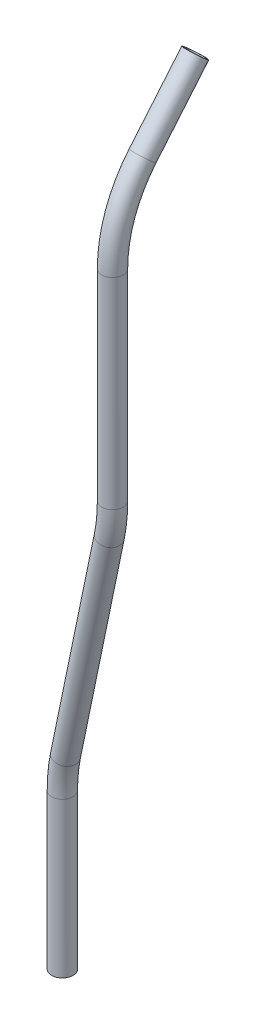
SolidWorks part; units mm, degrees
ref_plane "Front Plane" through (0, 0, 0) normal (0, 0, 1) x (1, 0, 0)
ref_plane "Top Plane" through (0, 0, 0) normal (0, 1, 0) x (1, 0, 0)
ref_plane "Right Plane" through (0, 0, 0) normal (1, 0, 0) x (0, 0, -1)
sketch3d "3DSketch1"
  line L0 (0, 0, 0) -> (0, 45.784, 0)
  line L1 (1.258, 55.645, 0.3207) -> (18.6505, 122.6308, 4.7546)
  line L2 (19.9085, 132.4918, 5.0753) -> (19.9085, 191.9949, 5.0753)
  line L3 (19.9085, 216.4852, -3.8384) -> (19.9085, 235.0485, -19.4149)
  line L6 (19.9085, 229.8203, -15.0279) -> (19.9085, 238.9425, -22.6824) construction
  arc A0 (19.9085, 191.9949, 5.0753) -> (19.9085, 216.4852, -3.8384) centre (19.9085, 191.9949, -33.0247) ccw
  arc A1 (18.6505, 122.6308, 4.7546) -> (19.9085, 132.4918, 5.0753) centre (-17.0107, 132.4918, -4.3365) ccw
  arc A2 (0, 45.784, 0) -> (1.258, 55.645, 0.3207) centre (36.9192, 45.784, 9.4118) ccw
  point P4 (19.9085, 205.8622, 5.0753)
  point P7 (-18.1915, 191.9949, -33.0247)
  point P10 (19.9085, 127.4759, 5.0753)
  point P12 (-26.4225, 132.4918, 32.5827)
  point P15 (0, 50.8, 0)
  point P17 (46.331, 45.784, -27.5074)
  dimension "D5" = 38.1
  dimension "D1" = 50.8
  dimension "D2" = 9.525
  dimension "D3" = 38.1
  dimension "D4" = 15
other "Structural Member1"
ref_plane "Plane1" through (0, 0, 0) normal (0, 1, 0) x (1, 0, 0)
sketch "Sketch1" plane through (0, 0, 0) normal (0, 1, 0) x (1, 0, 0)
  circle A0 centre (0, 0) radius 3.175
  circle A1 centre (0, 0) radius 2.667
  point P4 (0, 0)
  dimension "D1" = 6.35
  dimension "D2" = 0.508
sketch3d "3DSketch2" [suppressed]
  line L0 (0, 0, 0) -> (0, -7.1635, 0)
  line L1 (5.6025, -26.6656, 7.2045) -> (6.8276, -28.331, 8.78)
  line L3 (9.6583, -41.9513, 18.8369) -> (8.0602, -50.4208, 23.7695)
  line L4 (9.1586, -44.6, 20.3795) -> (7.2422, -54.7562, 26.2944) construction
  arc A0 (6.8276, -28.331, 8.78) -> (9.6583, -41.9513, 18.8369) centre (-14.1219, -42.6465, 9.9387) ccw
  arc A1 (5.6025, -26.6656, 7.2045) -> (0, -7.1635, 0) centre (15.5923, -7.1635, 20.0509) ccw
  point P4 (11.1259, -34.1737, 14.3073)
  point P9 (-6.1876, -55.8903, -10.2308)
  point P12 (0, -19.05, 0)
  point P14 (35.6432, -7.1635, 4.4586)
  point P18 (-6.35, 25.2705, 14.9247)
  dimension "D4" = 25.4
  dimension "D1" = 19.05
  dimension "D2" = 9.525
  dimension "D3" = 19.05
other "Structural Member2"
ref_plane "Plane2" through (0, 0, 0) normal (0, -1, 0) x (1, 0, 0)
sketch "Sketch11" plane through (0, 0, 0) normal (0, -1, 0) x (1, 0, 0)
  circle A0 centre (0, 0) radius 3.175
  circle A1 centre (0, 0) radius 2.667
  point P4 (0, 0)
  dimension "D1" = 6.35
  dimension "D2" = 0.508
sketch3d "3DSketch3" [suppressed]
  line L0 (0, 0, 0) -> (0, 39.7406, 0)
  line L1 (2.1516, 60.1406, 5.5169) -> (11.3484, 100.0659, 29.0982)
  line L2 (13.5, 120.4659, 34.6151) -> (13.5, 185.6064, 34.6151)
  line L5 (13.5, 178.7814, 34.6151) -> (13.5, 190.6897, 34.6151) construction
  arc A0 (11.3484, 100.0659, 29.0982) -> (13.5, 120.4659, 34.6151) centre (-0.3436, 120.4659, -0.8809) ccw
  arc A1 (0, 39.7406, 0) -> (2.1516, 60.1406, 5.5169) centre (13.8436, 39.7406, 35.496) ccw
  point P9 (13.5, 109.4064, 34.6151)
  point P10 (-35.8396, 120.4659, 12.9626)
  point P13 (0, 50.8, 0)
  point P14 (49.3396, 39.7406, 21.6524)
  dimension "D4" = 38.1
  dimension "D1" = 50.8
  dimension "D2" = 9.525
  dimension "D3" = 76.2
other "Structural Member3"
ref_plane "Plane3" through (0, 0, 0) normal (0, 1, 0) x (1, 0, 0)
sketch "Sketch13" plane through (0, 0, 0) normal (0, 1, 0) x (1, 0, 0)
  circle A0 centre (0, 0) radius 3.175
  circle A1 centre (0, 0) radius 2.667
  point P4 (0, 0)
  dimension "D1" = 6.35
  dimension "D2" = 0.508
sketch3d "3DSketch4" [suppressed]
  line L0 (0, 0, 0) -> (0, 24.8015, 0)
  line L1 (-0.0187, 25.9982, 0.0022) -> (-2.4813, 104.8986, 0.2903)
  line L2 (-2.5, 106.0953, 0.2924) -> (-2.5, 130.8969, 0.2924)
  line L7 (-2.5, 136.8719, 0.2924) -> (-2.5, 138.305, 0.2924) construction
  arc A0 (0, 24.8015, 0) -> (-0.0187, 25.9982, 0.0022) centre (-37.842, 24.8015, 4.4266) ccw
  arc A1 (-2.4813, 104.8986, 0.2903) -> (-2.5, 106.0953, 0.2924) centre (35.342, 106.0953, -4.1342) ccw
  point P11 (0, 25.4, 0)
  point P12 (-33.4153, 24.8015, 42.2686)
  point P15 (-2.5, 105.4969, 0.2924)
  point P16 (30.9153, 106.0953, -41.9762)
  dimension "D3" = 38.1
  dimension "D1" = 25.4
  dimension "D2" = 9.525
other "Structural Member4"
ref_plane "Plane4" through (0, 0, 0) normal (0, 1, 0) x (1, 0, 0)
sketch "Sketch15" plane through (0, 0, 0) normal (0, 1, 0) x (1, 0, 0)
  circle A0 centre (0, 0) radius 3.175
  circle A1 centre (0, 0) radius 2.667
  point P4 (0, 0)
  dimension "D1" = 6.35
  dimension "D2" = 0.508
